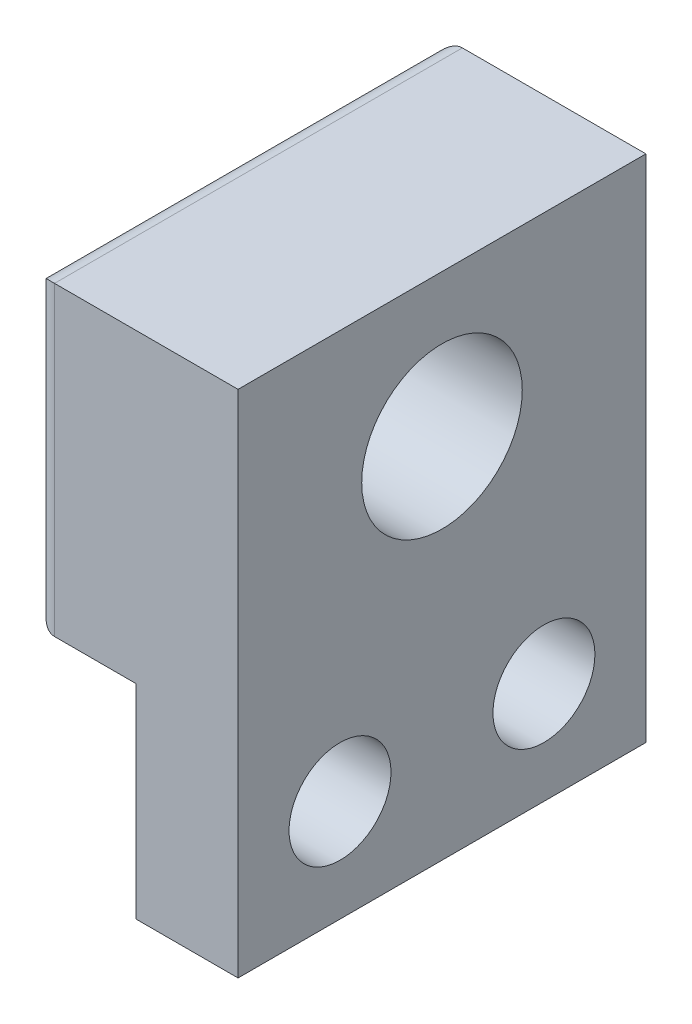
SolidWorks part; units mm, degrees
ref_plane "Front Plane" through (0, 0, 0) normal (0, 0, 1) x (1, 0, 0)
ref_plane "Top Plane" through (0, 0, 0) normal (0, 1, 0) x (1, 0, 0)
ref_plane "Right Plane" through (0, 0, 0) normal (1, 0, 0) x (0, 0, -1)
sketch "Sketch1" plane through (0, 0, 0) normal (0, 0, 1) x (1, 0, 0)
  line L1 (0, 0) -> (-12.7, 0)
  line L2 (0, 0) -> (0, 19.05)
  line L3 (0, 19.05) -> (-12.7, 19.05)
  line L4 (-12.7, 0) -> (-12.7, 19.05)
  line L5 (0, 0) -> (-6.35, 0)
  line L6 (0, 0) -> (0, -12.7)
  line L7 (0, -12.7) -> (-6.35, -12.7)
  line L8 (-6.35, 0) -> (-6.35, -12.7)
  dimension "D1" = 19.05
  dimension "D2" = 12.7
  dimension "D3" = 6.35
  dimension "D4" = 12.7
extrude "Boss-Extrude1" add sketch "Sketch1" against normal blind 25.4 contours L4 L1 L2 L3 | L1 L8 L7 L6
sketch "Sketch2" plane through (0, 0, 0) normal (1, 0, 0) x (0, 0, -1)
  line L0 (25.4, 10.16) -> (0, 10.16) construction
  line L1 (25.4, -12.7) -> (25.4, 19.05) construction
  line L2 (0, -12.7) -> (0, 19.05) construction
  line L3 (0, -6.35) -> (25.4, -6.35) construction
  line L4 (12.7, 19.05) -> (12.7, -12.7) construction
  line L5 (25.4, 19.05) -> (0, 19.05) construction
  line L6 (25.4, -12.7) -> (0, -12.7) construction
  line L7 (19.05, -6.35) -> (6.35, -6.35)
  circle A0 centre (12.7, 10.16) radius 5
  circle A1 centre (6.35, -6.35) radius 3.175
  circle A2 centre (19.05, -6.35) radius 3.175
  point P20 (12.7, -6.35)
  dimension "D1" = 10
  dimension "D2" = 6.35
  dimension "D3" = 12.7
  dimension "D4" = 8.89
  dimension "D5" = 6.35
extrude "Cut-Extrude1" cut sketch "Sketch2" against normal through all
fillet "Fillet1" radius 1.27 4 edges at (-12.7, 9.525, 0) (-12.7, 0, -12.7) (-12.7, 9.525, -25.4) (-12.7, 19.05, -12.7)
ref_plane "Plane1" through (0, 0, -12.7) normal (0, 0, -1) x (-1, 0, 0)
